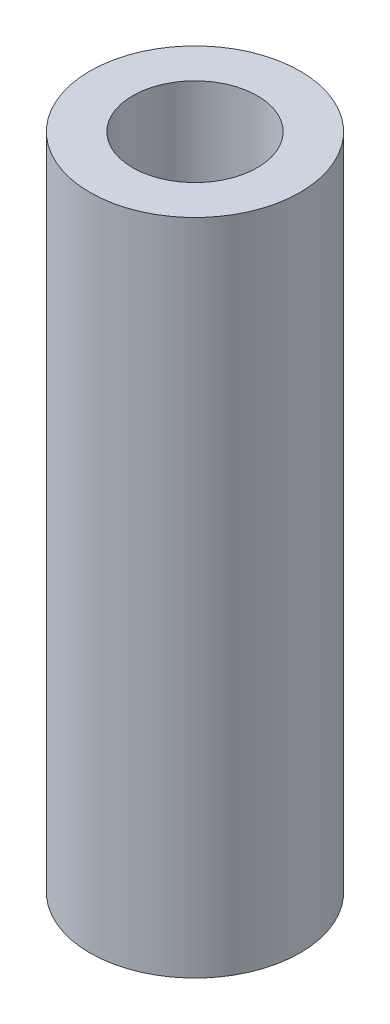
SolidWorks part; units mm, degrees
ref_plane "Front Plane" through (0, 0, 0) normal (0, 0, 1) x (1, 0, 0)
ref_plane "Top Plane" through (0, 0, 0) normal (0, 1, 0) x (1, 0, 0)
ref_plane "Right Plane" through (0, 0, 0) normal (1, 0, 0) x (0, 0, -1)
sketch "Sketch1" plane through (0, 0, 0) normal (0, 1, 0) x (1, 0, 0)
  circle A0 centre (0, 0) radius 19.05
  circle A1 centre (0, 0) radius 11.303
  dimension "D1" = 38.1
  dimension "D2" = 7.747
extrude "Boss-Extrude1" add sketch "Sketch1" against normal blind 119.38
ref_plane "Plane1" through (0, -25.4, 0) normal (0, 1, 0) x (-1, 0, 0)
sketch "Sketch2" plane through (0, -25.4, 0) normal (0, 1, 0) x (-1, 0, 0)
  line L0 (-1.905, 11.1413) -> (-1.0788, 9.654)
  line L1 (-1.0788, 9.654) -> (1.0788, 9.654)
  line L2 (1.0788, 9.654) -> (1.905, 11.1413)
  circle A0 centre (0, 0) radius 11.303 construction
  circle A1 centre (0, 0) radius 11.303
  point P5 (0, 9.654)
  dimension "D1" = 3.81
  dimension "D2" = 1.4873
  dimension "D3" = 58.101
extrude "Boss-Extrude2" add sketch "Sketch2" against normal blind 69.85 contours L2 A1 L0 L1
pattern_circular "CirPattern1" count 13 over 360 about axis through (0, 0, 0) along (0, 1, 0) of "Boss-Extrude2"
